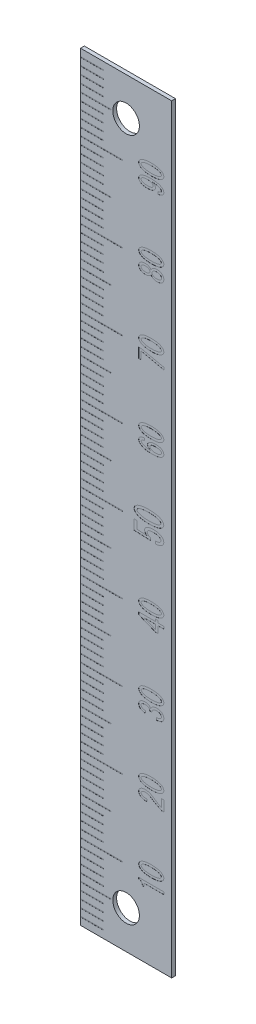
SolidWorks part; units mm, degrees
ref_plane "Front" through (0, 0, 0) normal (0, 0, 1) x (1, 0, 0)
ref_plane "Top" through (0, 0, 0) normal (0, 1, 0) x (1, 0, 0)
ref_plane "Right" through (0, 0, 0) normal (1, 0, 0) x (0, 0, -1)
sketch "Sketch1" plane through (0, 0, 0) normal (0, 0, 1) x (1, 0, 0)
  line L1 (0, 0) -> (0, 100)
  line L2 (0, 0) -> (12, 0)
  line L3 (12, 0) -> (12, 100)
  line L4 (0, 100) -> (12, 100)
  dimension "D1" = 100
  dimension "D2" = 12
extrude "Extrude1" add sketch "Sketch1" along normal blind 0.5
sketch "Sketch2" plane through (0, 0, 0.5) normal (0, 0, 1) x (1, 0, 0)
  line L0 (0, 100) -> (0, 0) construction
  line L1 (0, 0) -> (12, 0) construction
  line L2 (12, 100) -> (0, 100) construction
  circle A0 centre (6, 5) radius 1.75
  circle A1 centre (6, 95) radius 1.75
  dimension "D1" = 6
  dimension "D2" = 6
  dimension "D3" = 5
  dimension "D4" = 5
  dimension "D5" = 3.5
  dimension "D6" = 3.5
extrude "Extrude2" cut sketch "Sketch2" against normal through all
sketch "Sketch3" plane through (0, 0, 0.5) normal (0, 0, 1) x (1, 0, 0)
  line L0 (12, 100) -> (0, 100) construction
  line L1 (7.5, 88.25) -> (11, 88.25) construction
  line L2 (7.5, 88.25) -> (7.5, 91.75) construction
  line L3 (7.5, 91.75) -> (11, 91.75) construction
  line L4 (11, 88.25) -> (11, 91.75) construction
  line L6 (11, 78.25) -> (11, 81.75) construction
  line L7 (11, 68.25) -> (11, 71.75) construction
  line L8 (11, 58.25) -> (11, 61.75) construction
  line L9 (11, 48.25) -> (11, 51.75) construction
  line L10 (11, 38.25) -> (11, 41.75) construction
  line L11 (11, 28.25) -> (11, 31.75) construction
  line L12 (11, 18.25) -> (11, 21.75) construction
  line L13 (11, 8.25) -> (11, 11.75) construction
  line L14 (12, 0) -> (12, 100) construction
  line L16 (11, -1.75) -> (11, 1.75) construction
  text T0 "90" font "ＭＳ ゴシック" height in points 11
  text T1 "80  " font "ＭＳ ゴシック" height in points 11
  text T2 "70" font "ＭＳ ゴシック" height in points 11
  text T3 "60" font "ＭＳ ゴシック" height in points 11
  text T4 "50" font "ＭＳ ゴシック" height in points 13
  text T5 "40  " font "ＭＳ ゴシック" height in points 11
  text T6 "30" font "ＭＳ ゴシック" height in points 11
  text T7 "20" font "ＭＳ ゴシック" height in points 11
  text T8 "10" font "ＭＳ ゴシック" height in points 11
  point P4 (11, 90)
  dimension "D1" = 3.5
  dimension "D2" = 10
  dimension "D3" = 1
  dimension "D4" = 3.5
  dimension "D5" = 4
  dimension "D6" = 7
extrude "Extrude3" cut sketch "Sketch3" against normal blind 0.01
sketch "Sketch4" plane through (0, 0, 0.5) normal (0, 0, 1) x (1, 0, 0)
  line L5 (12, 100) -> (0, 100) construction
  line L406 (6, 100) -> (6, 0) construction
  line L407 (0, 0) -> (12, 0) construction
  line L408 (3, 1.05) -> (3, 0.95)
  line L409 (0, 0.95) -> (3, 0.95)
  line L410 (0, 1.05) -> (3, 1.05)
  line L411 (0, 1.05) -> (0, 0.95)
  line L412 (3, 2.05) -> (3, 1.95)
  line L413 (0, 1.95) -> (3, 1.95)
  line L414 (0, 2.05) -> (3, 2.05)
  line L415 (0, 2.05) -> (0, 1.95)
  line L416 (3, 3.05) -> (3, 2.95)
  line L417 (0, 2.95) -> (3, 2.95)
  line L418 (0, 3.05) -> (3, 3.05)
  line L419 (0, 3.05) -> (0, 2.95)
  line L420 (3, 4.05) -> (3, 3.95)
  line L421 (0, 3.95) -> (3, 3.95)
  line L422 (0, 4.05) -> (3, 4.05)
  line L423 (0, 4.05) -> (0, 3.95)
  line L424 (3, 6.05) -> (3, 5.95)
  line L425 (0, 5.95) -> (3, 5.95)
  line L426 (0, 6.05) -> (3, 6.05)
  line L427 (0, 6.05) -> (0, 5.95)
  line L428 (3, 7.05) -> (3, 6.95)
  line L429 (0, 6.95) -> (3, 6.95)
  line L430 (0, 7.05) -> (3, 7.05)
  line L431 (0, 7.05) -> (0, 6.95)
  line L432 (3, 8.05) -> (3, 7.95)
  line L433 (0, 7.95) -> (3, 7.95)
  line L434 (0, 8.05) -> (3, 8.05)
  line L435 (3, 9.05) -> (3, 8.95)
  line L436 (0, 8.95) -> (3, 8.95)
  line L437 (0, 9.05) -> (0, 8.95)
  line L438 (0, 9.05) -> (3, 9.05)
  line L439 (4, 4.95) -> (4, 5.05)
  line L440 (0, 5.05) -> (4, 5.05)
  line L441 (0, 4.95) -> (0, 5.05)
  line L442 (0, 4.95) -> (4, 4.95)
  line L443 (0, 8.05) -> (0, 7.95)
  line L444 (0, 9.95) -> (0, 10.05)
  line L445 (5.5, 9.95) -> (0, 9.95)
  line L446 (5.5, 10.05) -> (5.5, 9.95)
  line L447 (0, 10.05) -> (5.5, 10.05)
  line L448 (3, 11.05) -> (3, 10.95)
  line L449 (0, 10.95) -> (3, 10.95)
  line L450 (0, 11.05) -> (3, 11.05)
  line L451 (0, 11.05) -> (0, 10.95)
  line L452 (3, 12.05) -> (3, 11.95)
  line L453 (0, 11.95) -> (3, 11.95)
  line L454 (0, 12.05) -> (3, 12.05)
  line L455 (0, 12.05) -> (0, 11.95)
  line L456 (3, 13.05) -> (3, 12.95)
  line L457 (0, 12.95) -> (3, 12.95)
  line L458 (0, 13.05) -> (3, 13.05)
  line L459 (0, 13.05) -> (0, 12.95)
  line L460 (3, 14.05) -> (3, 13.95)
  line L461 (0, 13.95) -> (3, 13.95)
  line L462 (0, 14.05) -> (3, 14.05)
  line L463 (0, 14.05) -> (0, 13.95)
  line L464 (3, 16.05) -> (3, 15.95)
  line L465 (0, 15.95) -> (3, 15.95)
  line L466 (0, 16.05) -> (3, 16.05)
  line L467 (0, 16.05) -> (0, 15.95)
  line L468 (3, 17.05) -> (3, 16.95)
  line L469 (0, 16.95) -> (3, 16.95)
  line L470 (0, 17.05) -> (3, 17.05)
  line L471 (0, 17.05) -> (0, 16.95)
  line L472 (3, 18.05) -> (3, 17.95)
  line L473 (0, 17.95) -> (3, 17.95)
  line L474 (0, 18.05) -> (3, 18.05)
  line L475 (3, 19.05) -> (3, 18.95)
  line L476 (0, 18.95) -> (3, 18.95)
  line L477 (0, 19.05) -> (0, 18.95)
  line L478 (0, 19.05) -> (3, 19.05)
  line L479 (4, 14.95) -> (4, 15.05)
  line L480 (0, 15.05) -> (4, 15.05)
  line L481 (0, 14.95) -> (0, 15.05)
  line L482 (0, 14.95) -> (4, 14.95)
  line L483 (0, 18.05) -> (0, 17.95)
  line L484 (0, 19.95) -> (0, 20.05)
  line L485 (5.5, 19.95) -> (0, 19.95)
  line L486 (5.5, 20.05) -> (5.5, 19.95)
  line L487 (0, 20.05) -> (5.5, 20.05)
  line L488 (3, 21.05) -> (3, 20.95)
  line L489 (0, 20.95) -> (3, 20.95)
  line L490 (0, 21.05) -> (3, 21.05)
  line L491 (0, 21.05) -> (0, 20.95)
  line L492 (3, 22.05) -> (3, 21.95)
  line L493 (0, 21.95) -> (3, 21.95)
  line L494 (0, 22.05) -> (3, 22.05)
  line L495 (0, 22.05) -> (0, 21.95)
  line L496 (3, 23.05) -> (3, 22.95)
  line L497 (0, 22.95) -> (3, 22.95)
  line L498 (0, 23.05) -> (3, 23.05)
  line L499 (0, 23.05) -> (0, 22.95)
  line L500 (3, 24.05) -> (3, 23.95)
  line L501 (0, 23.95) -> (3, 23.95)
  line L502 (0, 24.05) -> (3, 24.05)
  line L503 (0, 24.05) -> (0, 23.95)
  line L504 (3, 26.05) -> (3, 25.95)
  line L505 (0, 25.95) -> (3, 25.95)
  line L506 (0, 26.05) -> (3, 26.05)
  line L507 (0, 26.05) -> (0, 25.95)
  line L508 (3, 27.05) -> (3, 26.95)
  line L509 (0, 26.95) -> (3, 26.95)
  line L510 (0, 27.05) -> (3, 27.05)
  line L511 (0, 27.05) -> (0, 26.95)
  line L512 (3, 28.05) -> (3, 27.95)
  line L513 (0, 27.95) -> (3, 27.95)
  line L514 (0, 28.05) -> (3, 28.05)
  line L515 (3, 29.05) -> (3, 28.95)
  line L516 (0, 28.95) -> (3, 28.95)
  line L517 (0, 29.05) -> (0, 28.95)
  line L518 (0, 29.05) -> (3, 29.05)
  line L519 (4, 24.95) -> (4, 25.05)
  line L520 (0, 25.05) -> (4, 25.05)
  line L521 (0, 24.95) -> (0, 25.05)
  line L522 (0, 24.95) -> (4, 24.95)
  line L523 (0, 28.05) -> (0, 27.95)
  line L524 (0, 29.95) -> (0, 30.05)
  line L525 (5.5, 29.95) -> (0, 29.95)
  line L526 (5.5, 30.05) -> (5.5, 29.95)
  line L527 (0, 30.05) -> (5.5, 30.05)
  line L528 (3, 31.05) -> (3, 30.95)
  line L529 (0, 30.95) -> (3, 30.95)
  line L530 (0, 31.05) -> (3, 31.05)
  line L531 (0, 31.05) -> (0, 30.95)
  line L532 (3, 32.05) -> (3, 31.95)
  line L533 (0, 31.95) -> (3, 31.95)
  line L534 (0, 32.05) -> (3, 32.05)
  line L535 (0, 32.05) -> (0, 31.95)
  line L536 (3, 33.05) -> (3, 32.95)
  line L537 (0, 32.95) -> (3, 32.95)
  line L538 (0, 33.05) -> (3, 33.05)
  line L539 (0, 33.05) -> (0, 32.95)
  line L540 (3, 34.05) -> (3, 33.95)
  line L541 (0, 33.95) -> (3, 33.95)
  line L542 (0, 34.05) -> (3, 34.05)
  line L543 (0, 34.05) -> (0, 33.95)
  line L544 (3, 36.05) -> (3, 35.95)
  line L545 (0, 35.95) -> (3, 35.95)
  line L546 (0, 36.05) -> (3, 36.05)
  line L547 (0, 36.05) -> (0, 35.95)
  line L548 (3, 37.05) -> (3, 36.95)
  line L549 (0, 36.95) -> (3, 36.95)
  line L550 (0, 37.05) -> (3, 37.05)
  line L551 (0, 37.05) -> (0, 36.95)
  line L552 (3, 38.05) -> (3, 37.95)
  line L553 (0, 37.95) -> (3, 37.95)
  line L554 (0, 38.05) -> (3, 38.05)
  line L555 (3, 39.05) -> (3, 38.95)
  line L556 (0, 38.95) -> (3, 38.95)
  line L557 (0, 39.05) -> (0, 38.95)
  line L558 (0, 39.05) -> (3, 39.05)
  line L559 (4, 34.95) -> (4, 35.05)
  line L560 (0, 35.05) -> (4, 35.05)
  line L561 (0, 34.95) -> (0, 35.05)
  line L562 (0, 34.95) -> (4, 34.95)
  line L563 (0, 38.05) -> (0, 37.95)
  line L564 (0, 39.95) -> (0, 40.05)
  line L565 (5.5, 39.95) -> (0, 39.95)
  line L566 (5.5, 40.05) -> (5.5, 39.95)
  line L567 (0, 40.05) -> (5.5, 40.05)
  line L568 (3, 41.05) -> (3, 40.95)
  line L569 (0, 40.95) -> (3, 40.95)
  line L570 (0, 41.05) -> (3, 41.05)
  line L571 (0, 41.05) -> (0, 40.95)
  line L572 (3, 42.05) -> (3, 41.95)
  line L573 (0, 41.95) -> (3, 41.95)
  line L574 (0, 42.05) -> (3, 42.05)
  line L575 (0, 42.05) -> (0, 41.95)
  line L576 (3, 43.05) -> (3, 42.95)
  line L577 (0, 42.95) -> (3, 42.95)
  line L578 (0, 43.05) -> (3, 43.05)
  line L579 (0, 43.05) -> (0, 42.95)
  line L580 (3, 44.05) -> (3, 43.95)
  line L581 (0, 43.95) -> (3, 43.95)
  line L582 (0, 44.05) -> (3, 44.05)
  line L583 (0, 44.05) -> (0, 43.95)
  line L584 (3, 46.05) -> (3, 45.95)
  line L585 (0, 45.95) -> (3, 45.95)
  line L586 (0, 46.05) -> (3, 46.05)
  line L587 (0, 46.05) -> (0, 45.95)
  line L588 (3, 47.05) -> (3, 46.95)
  line L589 (0, 46.95) -> (3, 46.95)
  line L590 (0, 47.05) -> (3, 47.05)
  line L591 (0, 47.05) -> (0, 46.95)
  line L592 (3, 48.05) -> (3, 47.95)
  line L593 (0, 47.95) -> (3, 47.95)
  line L594 (0, 48.05) -> (3, 48.05)
  line L595 (3, 49.05) -> (3, 48.95)
  line L596 (0, 48.95) -> (3, 48.95)
  line L597 (0, 49.05) -> (0, 48.95)
  line L598 (0, 49.05) -> (3, 49.05)
  line L599 (4, 44.95) -> (4, 45.05)
  line L600 (0, 45.05) -> (4, 45.05)
  line L601 (0, 44.95) -> (0, 45.05)
  line L602 (0, 44.95) -> (4, 44.95)
  line L603 (0, 48.05) -> (0, 47.95)
  line L604 (3, 51.05) -> (3, 50.95)
  line L605 (0, 50.95) -> (3, 50.95)
  line L606 (0, 51.05) -> (3, 51.05)
  line L607 (0, 51.05) -> (0, 50.95)
  line L608 (3, 52.05) -> (3, 51.95)
  line L609 (0, 51.95) -> (3, 51.95)
  line L610 (0, 52.05) -> (3, 52.05)
  line L611 (0, 52.05) -> (0, 51.95)
  line L612 (3, 53.05) -> (3, 52.95)
  line L613 (0, 52.95) -> (3, 52.95)
  line L614 (0, 53.05) -> (3, 53.05)
  line L615 (0, 53.05) -> (0, 52.95)
  line L616 (3, 54.05) -> (3, 53.95)
  line L617 (0, 53.95) -> (3, 53.95)
  line L618 (0, 54.05) -> (3, 54.05)
  line L619 (0, 54.05) -> (0, 53.95)
  line L620 (3, 56.05) -> (3, 55.95)
  line L621 (0, 55.95) -> (3, 55.95)
  line L622 (0, 56.05) -> (3, 56.05)
  line L623 (0, 56.05) -> (0, 55.95)
  line L624 (3, 57.05) -> (3, 56.95)
  line L625 (0, 56.95) -> (3, 56.95)
  line L626 (0, 57.05) -> (3, 57.05)
  line L627 (0, 57.05) -> (0, 56.95)
  line L628 (3, 58.05) -> (3, 57.95)
  line L629 (0, 57.95) -> (3, 57.95)
  line L630 (0, 58.05) -> (3, 58.05)
  line L631 (3, 59.05) -> (3, 58.95)
  line L632 (0, 58.95) -> (3, 58.95)
  line L633 (0, 59.05) -> (0, 58.95)
  line L634 (0, 59.05) -> (3, 59.05)
  line L635 (4, 54.95) -> (4, 55.05)
  line L636 (0, 55.05) -> (4, 55.05)
  line L637 (0, 54.95) -> (0, 55.05)
  line L638 (0, 54.95) -> (4, 54.95)
  line L639 (0, 58.05) -> (0, 57.95)
  line L640 (0, 49.95) -> (0, 50.05)
  line L641 (5.5, 49.95) -> (0, 49.95)
  line L642 (5.5, 50.05) -> (5.5, 49.95)
  line L643 (0, 50.05) -> (5.5, 50.05)
  line L644 (3, 61.05) -> (3, 60.95)
  line L645 (0, 60.95) -> (3, 60.95)
  line L646 (0, 61.05) -> (3, 61.05)
  line L647 (0, 61.05) -> (0, 60.95)
  line L648 (3, 62.05) -> (3, 61.95)
  line L649 (0, 61.95) -> (3, 61.95)
  line L650 (0, 62.05) -> (3, 62.05)
  line L651 (0, 62.05) -> (0, 61.95)
  line L652 (3, 63.05) -> (3, 62.95)
  line L653 (0, 62.95) -> (3, 62.95)
  line L654 (0, 63.05) -> (3, 63.05)
  line L655 (0, 63.05) -> (0, 62.95)
  line L656 (3, 64.05) -> (3, 63.95)
  line L657 (0, 63.95) -> (3, 63.95)
  line L658 (0, 64.05) -> (3, 64.05)
  line L659 (0, 64.05) -> (0, 63.95)
  line L660 (3, 66.05) -> (3, 65.95)
  line L661 (0, 65.95) -> (3, 65.95)
  line L662 (0, 66.05) -> (3, 66.05)
  line L663 (0, 66.05) -> (0, 65.95)
  line L664 (3, 67.05) -> (3, 66.95)
  line L665 (0, 66.95) -> (3, 66.95)
  line L666 (0, 67.05) -> (3, 67.05)
  line L667 (0, 67.05) -> (0, 66.95)
  line L668 (3, 68.05) -> (3, 67.95)
  line L669 (0, 67.95) -> (3, 67.95)
  line L670 (0, 68.05) -> (3, 68.05)
  line L671 (3, 69.05) -> (3, 68.95)
  line L672 (0, 68.95) -> (3, 68.95)
  line L673 (0, 69.05) -> (0, 68.95)
  line L674 (0, 69.05) -> (3, 69.05)
  line L675 (4, 64.95) -> (4, 65.05)
  line L676 (0, 65.05) -> (4, 65.05)
  line L677 (0, 64.95) -> (0, 65.05)
  line L678 (0, 64.95) -> (4, 64.95)
  line L679 (0, 68.05) -> (0, 67.95)
  line L680 (0, 59.95) -> (0, 60.05)
  line L681 (5.5, 59.95) -> (0, 59.95)
  line L682 (5.5, 60.05) -> (5.5, 59.95)
  line L683 (0, 60.05) -> (5.5, 60.05)
  line L684 (3, 71.05) -> (3, 70.95)
  line L685 (0, 70.95) -> (3, 70.95)
  line L686 (0, 71.05) -> (3, 71.05)
  line L687 (0, 71.05) -> (0, 70.95)
  line L688 (3, 72.05) -> (3, 71.95)
  line L689 (0, 71.95) -> (3, 71.95)
  line L690 (0, 72.05) -> (3, 72.05)
  line L691 (0, 72.05) -> (0, 71.95)
  line L692 (3, 73.05) -> (3, 72.95)
  line L693 (0, 72.95) -> (3, 72.95)
  line L694 (0, 73.05) -> (3, 73.05)
  line L695 (0, 73.05) -> (0, 72.95)
  line L696 (3, 74.05) -> (3, 73.95)
  line L697 (0, 73.95) -> (3, 73.95)
  line L698 (0, 74.05) -> (3, 74.05)
  line L699 (0, 74.05) -> (0, 73.95)
  line L700 (3, 76.05) -> (3, 75.95)
  line L701 (0, 75.95) -> (3, 75.95)
  line L702 (0, 76.05) -> (3, 76.05)
  line L703 (0, 76.05) -> (0, 75.95)
  line L704 (3, 77.05) -> (3, 76.95)
  line L705 (0, 76.95) -> (3, 76.95)
  line L706 (0, 77.05) -> (3, 77.05)
  line L707 (0, 77.05) -> (0, 76.95)
  line L708 (3, 78.05) -> (3, 77.95)
  line L709 (0, 77.95) -> (3, 77.95)
  line L710 (0, 78.05) -> (3, 78.05)
  line L711 (3, 79.05) -> (3, 78.95)
  line L712 (0, 78.95) -> (3, 78.95)
  line L713 (0, 79.05) -> (0, 78.95)
  line L714 (0, 79.05) -> (3, 79.05)
  line L715 (4, 74.95) -> (4, 75.05)
  line L716 (0, 75.05) -> (4, 75.05)
  line L717 (0, 74.95) -> (0, 75.05)
  line L718 (0, 74.95) -> (4, 74.95)
  line L719 (0, 78.05) -> (0, 77.95)
  line L720 (0, 69.95) -> (0, 70.05)
  line L721 (5.5, 69.95) -> (0, 69.95)
  line L722 (5.5, 70.05) -> (5.5, 69.95)
  line L723 (0, 70.05) -> (5.5, 70.05)
  line L724 (3, 81.05) -> (3, 80.95)
  line L725 (0, 80.95) -> (3, 80.95)
  line L726 (0, 81.05) -> (3, 81.05)
  line L727 (0, 81.05) -> (0, 80.95)
  line L728 (3, 82.05) -> (3, 81.95)
  line L729 (0, 81.95) -> (3, 81.95)
  line L730 (0, 82.05) -> (3, 82.05)
  line L731 (0, 82.05) -> (0, 81.95)
  line L732 (3, 83.05) -> (3, 82.95)
  line L733 (0, 82.95) -> (3, 82.95)
  line L734 (0, 83.05) -> (3, 83.05)
  line L735 (0, 83.05) -> (0, 82.95)
  line L736 (3, 84.05) -> (3, 83.95)
  line L737 (0, 83.95) -> (3, 83.95)
  line L738 (0, 84.05) -> (3, 84.05)
  line L739 (0, 84.05) -> (0, 83.95)
  line L740 (3, 86.05) -> (3, 85.95)
  line L741 (0, 85.95) -> (3, 85.95)
  line L742 (0, 86.05) -> (3, 86.05)
  line L743 (0, 86.05) -> (0, 85.95)
  line L744 (3, 87.05) -> (3, 86.95)
  line L745 (0, 86.95) -> (3, 86.95)
  line L746 (0, 87.05) -> (3, 87.05)
  line L747 (0, 87.05) -> (0, 86.95)
  line L748 (3, 88.05) -> (3, 87.95)
  line L749 (0, 87.95) -> (3, 87.95)
  line L750 (0, 88.05) -> (3, 88.05)
  line L751 (3, 89.05) -> (3, 88.95)
  line L752 (0, 88.95) -> (3, 88.95)
  line L753 (0, 89.05) -> (0, 88.95)
  line L754 (0, 89.05) -> (3, 89.05)
  line L755 (4, 84.95) -> (4, 85.05)
  line L756 (0, 85.05) -> (4, 85.05)
  line L757 (0, 84.95) -> (0, 85.05)
  line L758 (0, 84.95) -> (4, 84.95)
  line L759 (0, 88.05) -> (0, 87.95)
  line L760 (3, 91.05) -> (3, 90.95)
  line L761 (0, 90.95) -> (3, 90.95)
  line L762 (0, 91.05) -> (3, 91.05)
  line L763 (0, 91.05) -> (0, 90.95)
  line L764 (3, 92.05) -> (3, 91.95)
  line L765 (0, 91.95) -> (3, 91.95)
  line L766 (0, 92.05) -> (3, 92.05)
  line L767 (0, 92.05) -> (0, 91.95)
  line L768 (3, 93.05) -> (3, 92.95)
  line L769 (0, 92.95) -> (3, 92.95)
  line L770 (0, 93.05) -> (3, 93.05)
  line L771 (0, 93.05) -> (0, 92.95)
  line L772 (3, 94.05) -> (3, 93.95)
  line L773 (0, 93.95) -> (3, 93.95)
  line L774 (0, 94.05) -> (3, 94.05)
  line L775 (0, 94.05) -> (0, 93.95)
  line L776 (0, 79.95) -> (0, 80.05)
  line L777 (5.5, 79.95) -> (0, 79.95)
  line L778 (5.5, 80.05) -> (5.5, 79.95)
  line L779 (0, 80.05) -> (5.5, 80.05)
  line L780 (3, 96.05) -> (3, 95.95)
  line L781 (0, 95.95) -> (3, 95.95)
  line L782 (0, 96.05) -> (3, 96.05)
  line L783 (0, 96.05) -> (0, 95.95)
  line L784 (3, 97.05) -> (3, 96.95)
  line L785 (0, 96.95) -> (3, 96.95)
  line L786 (0, 97.05) -> (3, 97.05)
  line L787 (0, 97.05) -> (0, 96.95)
  line L788 (3, 98.05) -> (3, 97.95)
  line L789 (0, 97.95) -> (3, 97.95)
  line L790 (0, 98.05) -> (3, 98.05)
  line L791 (3, 99.05) -> (3, 98.95)
  line L792 (0, 98.95) -> (3, 98.95)
  line L793 (0, 99.05) -> (0, 98.95)
  line L794 (0, 99.05) -> (3, 99.05)
  line L795 (4, 94.95) -> (4, 95.05)
  line L796 (0, 95.05) -> (4, 95.05)
  line L797 (0, 94.95) -> (0, 95.05)
  line L798 (0, 94.95) -> (4, 94.95)
  line L799 (0, 98.05) -> (0, 97.95)
  line L800 (0, 89.95) -> (0, 90.05)
  line L801 (5.5, 89.95) -> (0, 89.95)
  line L802 (5.5, 90.05) -> (5.5, 89.95)
  line L803 (0, 90.05) -> (5.5, 90.05)
extrude "Extrude4" cut sketch "Sketch4" against normal blind 0.01
move or copy body "Body-Move/Copy2" bodies to move or copy 105 copy no translate (-12, -50, 0)
move or copy body "Body-Move/Copy3" bodies to move or copy 107 copy no translate (0, 50, 0)
